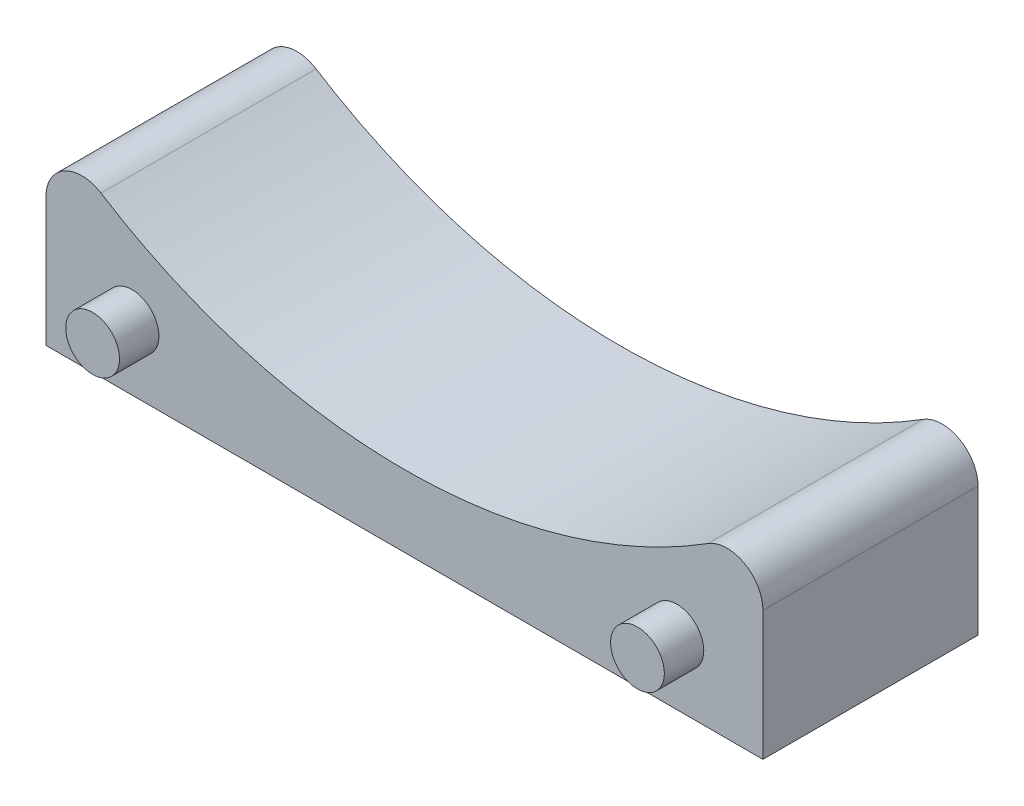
SolidWorks part; units mm, degrees
ref_plane "Front Plane" through (0, 0, 0) normal (0, 0, 1) x (1, 0, 0)
ref_plane "Top Plane" through (0, 0, 0) normal (0, 1, 0) x (1, 0, 0)
ref_plane "Right Plane" through (0, 0, 0) normal (1, 0, 0) x (0, 0, -1)
sketch "Sketch1" plane through (0, 0, 0) normal (0, 1, 0) x (1, 0, 0)
  circle A0 centre (0, 0) radius 35
  dimension "D1" = 70
extrude "Boss-Extrude1" add sketch "Sketch1" along normal blind 2
sketch "Sketch2" plane through (0, 2, 0) normal (0, 1, 0) x (1, 0, 0)
  circle A0 centre (-17.75, 17.75) radius 3.25
  circle A1 centre (17.75, 17.75) radius 3.25
  circle A2 centre (17.75, -17.75) radius 3.25
  circle A3 centre (-17.75, -17.75) radius 3.25
  dimension "D1" = 6.5
  dimension "D2" = 35.5
  dimension "D3" = 17.75
  dimension "D4" = 35.5
  dimension "D5" = 17.75
  dimension "D6" = 35.5
  dimension "D7" = 17.75
  dimension "D8" = 35.5
  dimension "D9" = 17.75
sketch "Sketch4" plane through (0, 2, 0) normal (0, 1, 0) x (1, 0, 0)
  line L0 (-25.4755, -24) -> (25.4755, -24)
  arc A0 (-25.4755, -24) -> (25.4755, -24) centre (0, 0) ccw
  dimension "D1" = 24
extrude "Cut-Extrude3" cut sketch "Sketch4" against normal blind 10
extrude "Cut-Extrude4" cut sketch "Sketch2" against normal through all
sketch "Sketch5" plane through (0, 0, 24) normal (0, 0, 1) x (1, 0, 0)
  line L0 (-50, 0) -> (50, 0)
  line L1 (50, 0) -> (50, 24)
  line L2 (50, 24) -> (-50, 24)
  line L3 (-50, 24) -> (-50, 0)
  dimension "D1" = 24
  dimension "D2" = 100
  dimension "D3" = 50
extrude "Boss-Extrude2" add sketch "Sketch5" along normal blind 120
sketch "Sketch7" plane through (0, 0, 144) normal (0, 0, 1) x (1, 0, 0)
  line L0 (50, 24) -> (-50, 24) construction
  line L1 (-50, 0) -> (50, 0) construction
  arc A0 (-45, 24) -> (45, 24) centre (0, 89.3214) ccw
  point P3 (0, 10)
  dimension "D3" = 10
  dimension "D1" = 90
  dimension "D2" = 45
extrude "Cut-Extrude6" cut sketch "Sketch7" against normal through all and the other way through all
sketch "Sketch9" plane through (0, 24, 0) normal (0, 1, 0) x (1, 0, 0)
  line L0 (-25.4755, -24) -> (25.4755, -24)
  arc A0 (-25.4755, -24) -> (25.4755, -24) centre (0, 0) ccw
extrude "Cut-Extrude7" cut sketch "Sketch9" against normal blind 22
sketch "Sketch11" plane through (0, 24, 0) normal (0, 1, 0) x (1, 0, 0)
  line L0 (0, -35) -> (-25.4755, -35)
  line L2 (-25.4755, -24) -> (-25.4755, -35)
  line L3 (-25.4755, -24) -> (25.4755, -24)
  line L4 (25.4755, -24) -> (25.4755, -35)
  line L6 (25.4755, -35) -> (0, -35)
  arc A0 (-25.4755, -24) -> (25.4755, -24) centre (0, 0) ccw construction
extrude "Cut-Extrude9" cut sketch "Sketch11" against normal blind 14
fillet "Fillet4" radius 20 4 edges at (25.4755, 14.2023, 29.5) (12.9099, 11.0576, 35) (-25.4755, 14.2023, 29.5) (-12.9099, 11.0576, 35)
fillet "Fillet6" radius 20 1 edges at (0, 10, 144)
fillet "Fillet7" radius 5 4 edges at (50, 1.7517, 144) (-50, 1.7517, 144) (50, 18.095, 139.7727) (-50, 13.5033, 142.1035)
ref_plane "Plane1" through (0, 0, 100) normal (0, 0, 1) x (1, 0, 0)
ref_plane "Plane2" through (0, 0, 70) normal (0, 0, 1) x (1, 0, 0)
ref_plane "Plane3" through (0, 0, 24) normal (0, 0, -1) x (-1, 0, 0)
sketch "Sketch12" plane through (0, 0, 100) normal (0, 0, 1) x (1, 0, 0)
  line L1 (-63.0783, 30.8273) -> (71.1208, 30.8273)
  line L2 (-63.0783, 30.8273) -> (-63.0783, -8.5967)
  line L3 (-63.0783, -8.5967) -> (71.1208, -8.5967)
  line L4 (71.1208, 30.8273) -> (71.1208, -8.5967)
extrude "Cut-Extrude10" cut sketch "Sketch12" along normal through all
sketch "Sketch13" plane through (0, 0, 70) normal (0, 0, 1) x (1, 0, 0)
  line L1 (-56.9281, 31.2966) -> (60.0821, 31.2966)
  line L2 (-56.9281, 31.2966) -> (-56.9281, -7.0235)
  line L3 (-56.9281, -7.0235) -> (60.0821, -7.0235)
  line L4 (60.0821, 31.2966) -> (60.0821, -7.0235)
extrude "Cut-Extrude11" cut sketch "Sketch13" against normal through all
sketch "Sketch14" plane through (0, 0, 100) normal (0, 0, 1) x (1, 0, 0)
  line L0 (-50, 0) -> (50, 0) construction
  circle A0 centre (-38, 9) radius 3.75
  circle A1 centre (38, 9) radius 3.75
  dimension "D3" = 7.5
  dimension "D4" = 7.5
  dimension "D1" = 9
  dimension "D2" = 9
  dimension "D5" = 38
  dimension "D6" = 38
extrude "Boss-Extrude3" add sketch "Sketch14" along normal blind 5.5
sketch "Sketch15" plane through (0, 0, 70) normal (0, 0, -1) x (-1, 0, 0)
  line L0 (50, 0) -> (-50, 0) construction
  circle A0 centre (-38, 9) radius 4
  circle A1 centre (38, 9) radius 4
  dimension "D3" = 8
  dimension "D5" = 8
  dimension "D1" = 9
  dimension "D2" = 38
  dimension "D4" = 38
extrude "Cut-Extrude12" cut sketch "Sketch15" against normal blind 6
